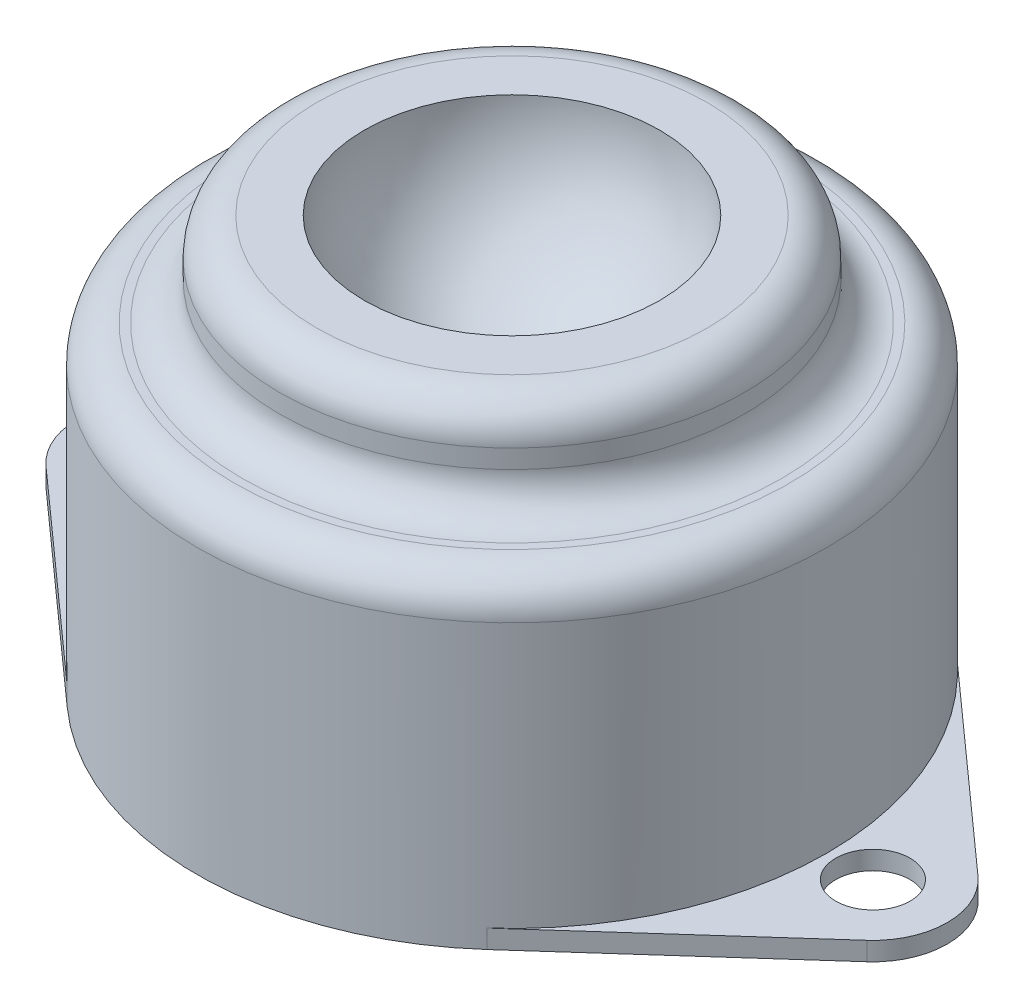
SolidWorks part; units mm, degrees
ref_plane "Front Plane" through (0, 0, 0) normal (0, 0, 1) x (1, 0, 0)
ref_plane "Top Plane" through (0, 0, 0) normal (0, 1, 0) x (1, 0, 0)
ref_plane "Right Plane" through (0, 0, 0) normal (1, 0, 0) x (0, 0, -1)
sketch "Sketch1" plane through (0, 0, 0) normal (0, 1, 0) x (1, 0, 0)
  line L4 (-11.2889, 12.6214) -> (-22.0667, 2.9814)
  line L5 (-22.0667, -2.9814) -> (-11.2889, -12.6214)
  line L6 (11.2889, 12.6214) -> (22.0667, 2.9814)
  line L7 (22.0667, -2.9814) -> (11.2889, -12.6214)
  circle A0 centre (0, 0) radius 16.9333
  arc A1 (22.0667, 2.9814) -> (22.0667, -2.9814) centre (19.4, 0) cw
  arc A2 (-22.0667, 2.9814) -> (-22.0667, -2.9814) centre (-19.4, 0) ccw
  circle A3 centre (-19.4, 0) radius 2
  circle A4 centre (19.4, 0) radius 2
  point P11 (25.4, 0)
  point P14 (-25.4, 0)
  dimension "D1" = 33.8667
  dimension "D3" = 4
  dimension "D4" = 4
  dimension "D2" = 50.8
extrude "Boss-Extrude1" add sketch "Sketch1" along normal blind 1 contours L4 A2 L5 A0 A3 | A0 | A1 L6 A0 L7 A4
sketch "Sketch2" plane through (0, 1, 0) normal (0, 1, 0) x (1, 0, 0)
  circle A0 centre (0, 0) radius 16.9333
  dimension "D1" = 33.8667
extrude "Boss-Extrude2" add sketch "Sketch2" along normal blind 21.225
sketch "Sketch3" plane through (0, 22.225, 0) normal (0, 1, 0) x (1, 0, 0)
  line L0 (0, 7.9375) -> (0, -7.9375)
  arc A0 (0, 7.9375) -> (0, -7.9375) centre (0, 0) ccw
  dimension "D1" = 15.875
revolve "Cut-Revolve2" cut sketch "Sketch3" angle 180 about L0
sketch "Sketch4" plane through (0, 22.225, 0) normal (0, 1, 0) x (1, 0, 0)
  circle A0 centre (0, 0) radius 16.9333
  circle A1 centre (0, 0) radius 12.5
  dimension "D1" = 33.8667
  dimension "D2" = 25
extrude "Cut-Extrude2" cut sketch "Sketch4" against normal blind 5
fillet "Fillet1" radius 2 3 edges at (0, 22.225, 12.5) (0, 17.225, 16.9333) (0, 17.225, 12.5)
